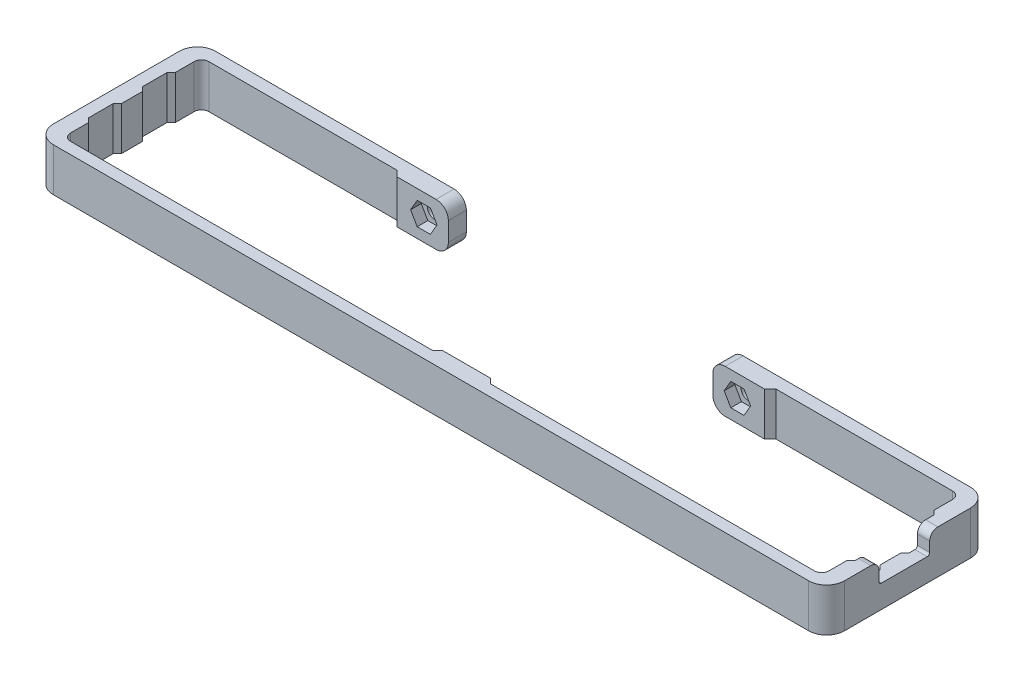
SolidWorks part; units mm, degrees
ref_plane "Front Plane" through (0, 0, 0) normal (0, 0, 1) x (1, 0, 0)
ref_plane "Top Plane" through (0, 0, 0) normal (0, 1, 0) x (1, 0, 0)
ref_plane "Right Plane" through (0, 0, 0) normal (1, 0, 0) x (0, 0, -1)
sketch "Sketch1" plane through (0, 0, 0) normal (0, 0, 1) x (1, 0, 0)
  line L1 (-72.0026, 47.8166) -> (121.3974, 47.8166)
  line L2 (-72.0026, 47.8166) -> (-72.0026, 37.2166)
  line L3 (-72.0026, 37.2166) -> (121.3974, 37.2166)
  line L4 (121.3974, 47.8166) -> (121.3974, 37.2166)
  dimension "D1" = 193.4
  dimension "D2" = 10.6
extrude "Boss-Extrude1" add sketch "Sketch1" along normal blind 4
ref_plane "Plane1" through (0, 0, 0) normal (0, 0, -1) x (-1, 0, 0)
sketch "Sketch2" plane through (0, 0, 0) normal (0, 0, -1) x (-1, 0, 0)
  line L0 (-121.3974, 47.8166) -> (72.0026, 47.8166) construction
  line L1 (-121.3974, 37.2166) -> (-117.3974, 37.2166)
  line L2 (-121.3974, 37.2166) -> (-121.3974, 47.8166)
  line L3 (-121.3974, 47.8166) -> (-117.3974, 47.8166)
  line L4 (-117.3974, 37.2166) -> (-117.3974, 47.8166)
  line L6 (72.0026, 37.2166) -> (68.0026, 37.2166)
  line L7 (72.0026, 37.2166) -> (72.0026, 47.8166)
  line L8 (72.0026, 47.8166) -> (68.0026, 47.8166)
  line L9 (68.0026, 37.2166) -> (68.0026, 47.8166)
  dimension "D1" = 4
  dimension "D2" = 4
extrude "Boss-Extrude2" add sketch "Sketch2" along normal blind 35.6
ref_plane "Plane2" through (0, 47.8166, 0) normal (0, 1, 0) x (1, 0, 0)
sketch "Sketch3" plane through (0, 47.8166, 0) normal (0, 1, 0) x (1, 0, 0)
  line L1 (-68.0026, 35.6) -> (-6.2626, 35.6)
  line L2 (-68.0026, 35.6) -> (-68.0026, 31.2)
  line L3 (-68.0026, 31.2) -> (-6.2626, 31.2)
  line L4 (-6.2626, 35.6) -> (-6.2626, 31.2)
  line L5 (117.3974, 35.6) -> (58.3974, 35.6)
  line L6 (117.3974, 35.6) -> (117.3974, 31.2)
  line L7 (117.3974, 31.2) -> (58.3974, 31.2)
  line L8 (58.3974, 35.6) -> (58.3974, 31.2)
  dimension "D1" = 4.4
  dimension "D2" = 4.4
  dimension "D3" = 61.74
  dimension "D4" = 59
extrude "Boss-Extrude3" add sketch "Sketch3" against normal blind 10.6
fillet "Fillet1" radius 4.4 4 edges at (121.3974, 42.5166, -35.6) (-72.0026, 42.5166, -35.6) (-72.0026, 42.5166, 4) (121.3974, 42.5166, 4)
ref_plane "Plane3" through (0, 0, -35.6) normal (0, 0, -1) x (-1, 0, 0)
sketch "Sketch4" plane through (0, 0, -35.6) normal (0, 0, -1) x (-1, 0, 0)
  line L0 (6.2626, 37.2166) -> (6.2626, 47.8166) construction
  line L1 (67.6026, 47.8166) -> (6.2626, 47.8166) construction
  line L2 (-58.3974, 47.8166) -> (-116.9974, 47.8166) construction
  line L3 (-58.3974, 37.2166) -> (-58.3974, 47.8166) construction
  circle A0 centre (12.2626, 42.5166) radius 1.7
  circle A1 centre (-64.3974, 42.5166) radius 1.7
  dimension "D1" = 3.4
  dimension "D2" = 3.4
  dimension "D3" = 6
  dimension "D4" = 5.3
  dimension "D5" = 5.3
  dimension "D6" = 6
extrude "Cut-Extrude1" cut sketch "Sketch4" against normal blind 10.6
ref_plane "Plane4" through (0, 0, -31.2) normal (0, 0, 1) x (1, 0, 0)
sketch "Sketch5" plane through (0, 0, -31.2) normal (0, 0, 1) x (1, 0, 0)
  line L1 (-10.646, 39.7166) -> (-9.0295, 42.5166)
  line L2 (-9.0295, 42.5166) -> (-10.646, 45.3166)
  line L3 (-10.646, 45.3166) -> (-13.8792, 45.3166)
  line L4 (-13.8792, 45.3166) -> (-15.4958, 42.5166)
  line L5 (-15.4958, 42.5166) -> (-13.8792, 39.7166)
  line L6 (-13.8792, 39.7166) -> (-10.646, 39.7166)
  line L7 (66.014, 39.7166) -> (67.6305, 42.5166)
  line L8 (67.6305, 42.5166) -> (66.014, 45.3166)
  line L9 (66.014, 45.3166) -> (62.7808, 45.3166)
  line L10 (62.7808, 45.3166) -> (61.1642, 42.5166)
  line L11 (61.1642, 42.5166) -> (62.7808, 39.7166)
  line L12 (62.7808, 39.7166) -> (66.014, 39.7166)
  circle A0 centre (-12.2626, 42.5166) radius 2.8 construction
  circle A1 centre (64.3974, 42.5166) radius 2.8 construction
  dimension "D1" = 5.6
  dimension "D2" = 5.6
extrude "Cut-Extrude2" cut sketch "Sketch5" against normal blind 2.6
sketch "Sketch6" plane through (0, 47.8166, 0) normal (0, 1, 0) x (1, 0, 0)
  line L0 (121.3974, 0.4) -> (121.3974, 31.2) construction
  line L1 (117.3974, 4) -> (118.3974, 4)
  line L2 (117.3974, 4) -> (117.3974, 14)
  line L3 (117.3974, 14) -> (118.3974, 14)
  line L4 (118.3974, 4) -> (118.3974, 14)
  line L5 (117.3974, 27.2) -> (118.3974, 27.2)
  line L6 (117.3974, 27.2) -> (117.3974, 17.2)
  line L7 (117.3974, 17.2) -> (118.3974, 17.2)
  line L8 (118.3974, 27.2) -> (118.3974, 17.2)
  line L9 (117.3974, 31.2) -> (117.3974, 0) construction
  line L10 (-68.0026, 4) -> (-69.0026, 4)
  line L11 (-68.0026, 4) -> (-68.0026, 14)
  line L12 (-68.0026, 14) -> (-69.0026, 14)
  line L13 (-69.0026, 4) -> (-69.0026, 14)
  line L14 (-68.0026, 27.2) -> (-69.0026, 27.2)
  line L15 (-68.0026, 27.2) -> (-68.0026, 17.2)
  line L16 (-68.0026, 17.2) -> (-69.0026, 17.2)
  line L17 (-69.0026, 27.2) -> (-69.0026, 17.2)
  line L18 (-68.0026, 31.2) -> (-68.0026, 0) construction
  line L19 (117.3974, 0) -> (-68.0026, 0) construction
  line L20 (58.3974, 31.2) -> (117.3974, 31.2) construction
  line L21 (-72.0026, 0.4) -> (-72.0026, 31.2) construction
  line L22 (-68.0026, 31.2) -> (-6.2626, 31.2) construction
  point P32 (117.8974, 4)
  dimension "D1" = 3
  dimension "D2" = 3
  dimension "D3" = 4
  dimension "D4" = 10
  dimension "D5" = 4
  dimension "D6" = 10
  dimension "D7" = 4
  dimension "D8" = 3
  dimension "D9" = 3
  dimension "D10" = 4
  dimension "D11" = 10
  dimension "D12" = 10
extrude "Cut-Extrude3" cut sketch "Sketch6" against normal blind 13.6
sketch "Sketch7" plane through (0, 47.8166, 0) normal (0, 1, 0) x (1, 0, 0)
  line L0 (116.9974, -4) -> (-67.6026, -4) construction
  line L1 (117.3974, 0) -> (34.3974, 0)
  line L2 (117.3974, 0) -> (117.3974, -1.2)
  line L3 (117.3974, -1.2) -> (34.3974, -1.2)
  line L4 (34.3974, 0) -> (34.3974, -1.2)
  line L5 (-68.0026, 0) -> (24.3974, 0)
  line L6 (-68.0026, 0) -> (-68.0026, -1.2)
  line L7 (-68.0026, -1.2) -> (24.3974, -1.2)
  line L8 (24.3974, 0) -> (24.3974, -1.2)
  line L9 (-67.6026, 35.6) -> (-6.2626, 35.6) construction
  line L10 (117.3974, 31.2) -> (70.3974, 31.2)
  line L11 (117.3974, 31.2) -> (117.3974, 32.6)
  line L12 (117.3974, 32.6) -> (70.3974, 32.6)
  line L13 (70.3974, 31.2) -> (70.3974, 32.6)
  line L14 (-68.0026, 31.2) -> (-18.2626, 31.2)
  line L15 (-68.0026, 31.2) -> (-68.0026, 32.6)
  line L16 (-68.0026, 32.6) -> (-18.2626, 32.6)
  line L17 (-18.2626, 31.2) -> (-18.2626, 32.6)
  line L18 (58.3974, 35.6) -> (116.9974, 35.6) construction
  line L19 (58.3974, 35.6) -> (58.3974, 31.2) construction
  line L20 (-6.2626, 31.2) -> (-6.2626, 35.6) construction
  point P26 (70.3974, 31.9)
  point P31 (-6.2626, 33.4)
  dimension "D1" = 10
  dimension "D2" = 83
  dimension "D3" = 2.8
  dimension "D4" = 2.8
  dimension "D5" = 3
  dimension "D6" = 3
  dimension "D7" = 12
  dimension "D8" = 12
extrude "Cut-Extrude4" cut sketch "Sketch7" against normal blind 13.6
chamfer "Chamfer1" distance 2 angle 45 12 edges at (70.3974, 42.5166, -32.6) (-18.2626, 42.5166, -32.6) (118.3974, 42.5166, -27.2) (118.3974, 42.5166, -4) (118.3974, 42.5166, -14) (118.3974, 42.5166, -17.2) (34.3974, 42.5166, 1.2) (24.3974, 42.5166, 1.2) (-69.0026, 42.5166, -14) (-69.0026, 42.5166, -4) (-69.0026, 42.5166, -17.2) (-69.0026, 42.5166, -27.2)
fillet "Fillet2" radius 1.8 4 edges at (117.3974, 42.5166, -32.6) (117.3974, 42.5166, 1.2) (-68.0026, 42.5166, -32.6) (-68.0026, 42.5166, 1.2)
fillet "Fillet3" radius 3 4 edges at (-6.2626, 37.2166, -33.4) (-6.2626, 47.8166, -33.4) (58.3974, 37.2166, -33.4) (58.3974, 47.8166, -33.4)
ref_plane "Plane5" through (121.3974, 0, 0) normal (1, 0, 0) x (0, 0, -1)
sketch "Sketch8" plane through (121.3974, 0, 0) normal (1, 0, 0) x (0, 0, -1)
  line L0 (0.4, 47.8166) -> (31.2, 47.8166) construction
  line L1 (8.8, 47.8166) -> (21.2, 47.8166)
  line L2 (8.8, 47.8166) -> (8.8, 42.8166)
  line L3 (8.8, 42.8166) -> (21.2, 42.8166)
  line L4 (21.2, 47.8166) -> (21.2, 42.8166)
  line L5 (0.4, 47.8166) -> (0.4, 37.2166) construction
  line L6 (31.2, 37.2166) -> (31.2, 47.8166) construction
  dimension "D1" = 8.4
  dimension "D2" = 10
  dimension "D3" = 5
extrude "Cut-Extrude5" cut sketch "Sketch8" against normal blind 10
ref_plane "Plane6" through (0, 0, 1.2) normal (0, 0, -1) x (-1, 0, 0)
sketch "Sketch9" plane through (0, 0, 1.2) normal (0, 0, -1) x (-1, 0, 0)
  line L0 (-96.9974, 40.8166) -> (-66.9974, 40.8166) construction
  line L1 (-116.9974, 37.2166) -> (-61.3974, 37.2166) construction
  line L2 (-116.9974, 47.8166) -> (-116.9974, 37.2166) construction
  text T0 "ROYAL EX P1" font "Century Gothic" height 3.5
  dimension "D1" = 3.6
  dimension "D2" = 20
  dimension "D3" = 30
extrude "Cut-Extrude6" cut sketch "Sketch9" against normal blind 0.6
fillet "Fillet4" radius 2 2 edges at (119.8974, 47.8166, -21.2) (119.8974, 47.8166, -8.8)
fillet "Fillet5" radius 0.6 2 edges at (119.8974, 42.8166, -21.2) (119.8974, 42.8166, -8.8)
